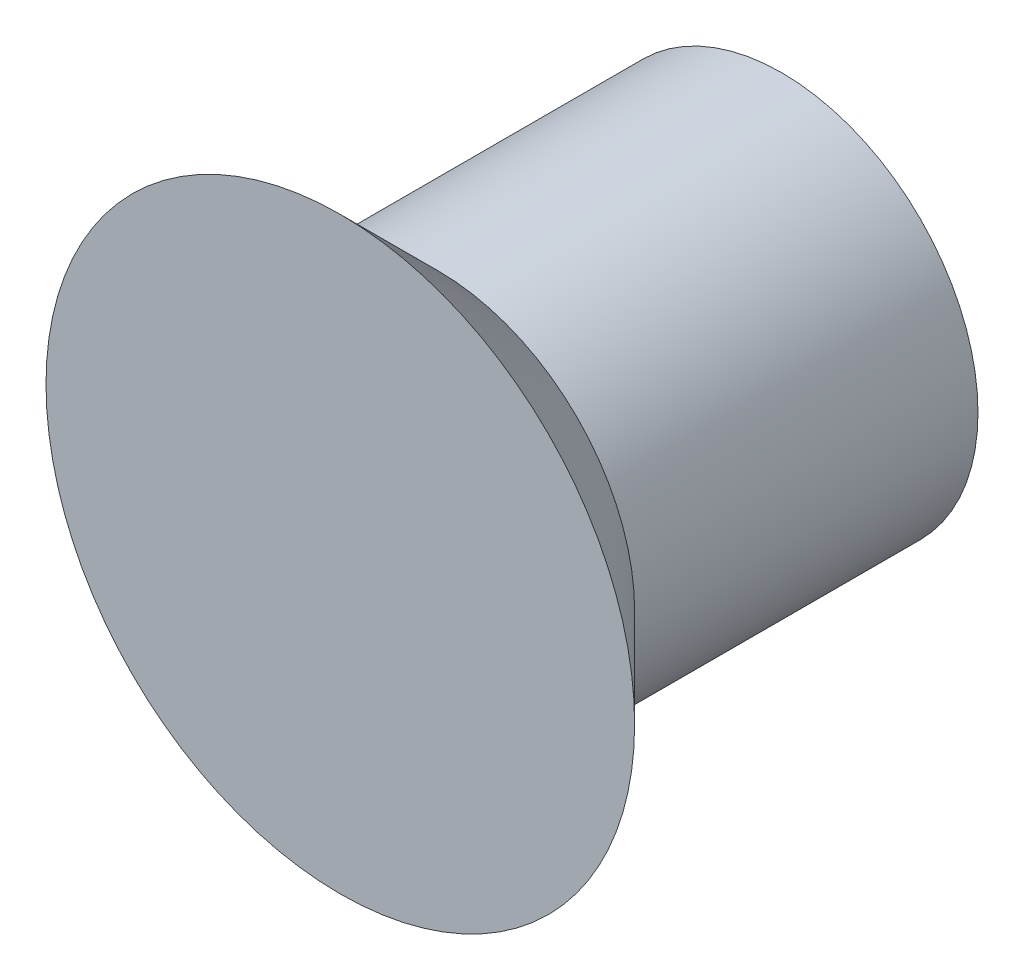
SolidWorks part; units mm, degrees
ref_plane "Ön Düzlem" through (0, 0, 0) normal (0, 0, 1) x (1, 0, 0)
ref_plane "Üst Düzlem" through (0, 0, 0) normal (0, 1, 0) x (1, 0, 0)
ref_plane "Sağ Düzlem" through (0, 0, 0) normal (1, 0, 0) x (0, 0, -1)
sketch "Çizim1" plane through (0, 0, 0) normal (0, 0, 1) x (1, 0, 0)
  circle A0 centre (0, 0) radius 2
  dimension "D1" = 4
extrude "Yükseklik-Ekstrüzyon1" add sketch "Çizim1" along normal blind 3.5
sketch "Çizim3" plane through (0, 0, 3.5) normal (0, 0, 1) x (1, 0, 0)
  circle A0 centre (0, 0) radius 2
  dimension "D1" = 4
extrude "Yükseklik-Ekstrüzyon3" add sketch "Çizim3" along normal blind 1 draft 45
